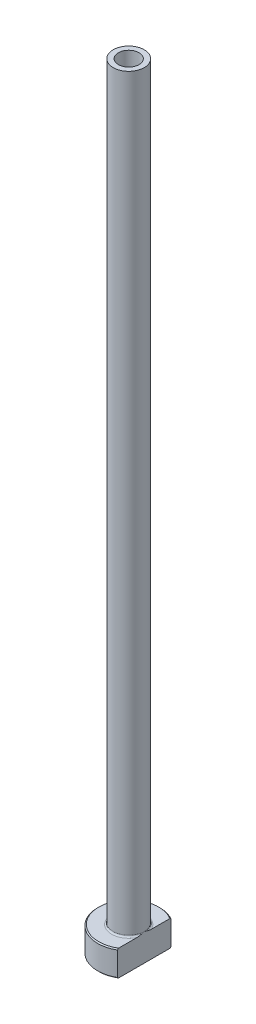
SolidWorks part; units mm, degrees
ref_plane "Front Plane" through (0, 0, 0) normal (0, 0, 1) x (1, 0, 0)
ref_plane "Top Plane" through (0, 0, 0) normal (0, 1, 0) x (1, 0, 0)
ref_plane "Right Plane" through (0, 0, 0) normal (1, 0, 0) x (0, 0, -1)
sketch "Sketch1" plane through (0, 0, 0) normal (0, 0, 1) x (1, 0, 0)
  line L0 (-2, 150) -> (-3, 150)
  line L1 (-3, 150) -> (-3, 5)
  line L2 (-3, 5) -> (-6, 5)
  line L3 (-6, 5) -> (-6, 0)
  line L4 (4.95, 0) -> (-4.95, 0) construction
  line L5 (-6, 0) -> (-2.25, 0)
  line L6 (-2, 105) -> (-2, 150)
  line L7 (0, 92.1877) -> (0, -15.5353) construction
  line L8 (0, -6.6) -> (0, 6.6) construction
  line L9 (-2, 105) -> (-2.25, 93)
  line L10 (-2.25, 93) -> (-2.25, 0)
  dimension "D1" = 0.25
  dimension "ID" = 4
  dimension "OD" = 6
  dimension "L" = 150
  dimension "H" = 12
  dimension "T" = 5
  dimension "N" = 45
  dimension "D2" = 12
  dimension "L-N" = 105
revolve "Revolve1" add sketch "Sketch1" angle 360 about L7
fillet "Fillet1" radius 0.3 1 edges at (0, 5, 3)
chamfer "Chamfer1" distance 0.2 angle 45 2 edges at (0, 5, 6) (0, 0, 6)
sketch "Sketch2" plane through (0, 0, 0) normal (0, -1, 0) x (1, 0, 0)
  line L0 (3, 5.1962) -> (3, -5.1962)
  circle A0 centre (0, 0) radius 6 construction
  arc A1 (3, 5.1962) -> (3, -5.1962) centre (0, 0) cw
  circle A2 centre (0, 0) radius 3 construction
extrude "Cut-Extrude1" cut sketch "Sketch2" against normal through all
chamfer "Chamfer2" distance 0.5 angle 45 1 edges at (0, 0, 2.25)
